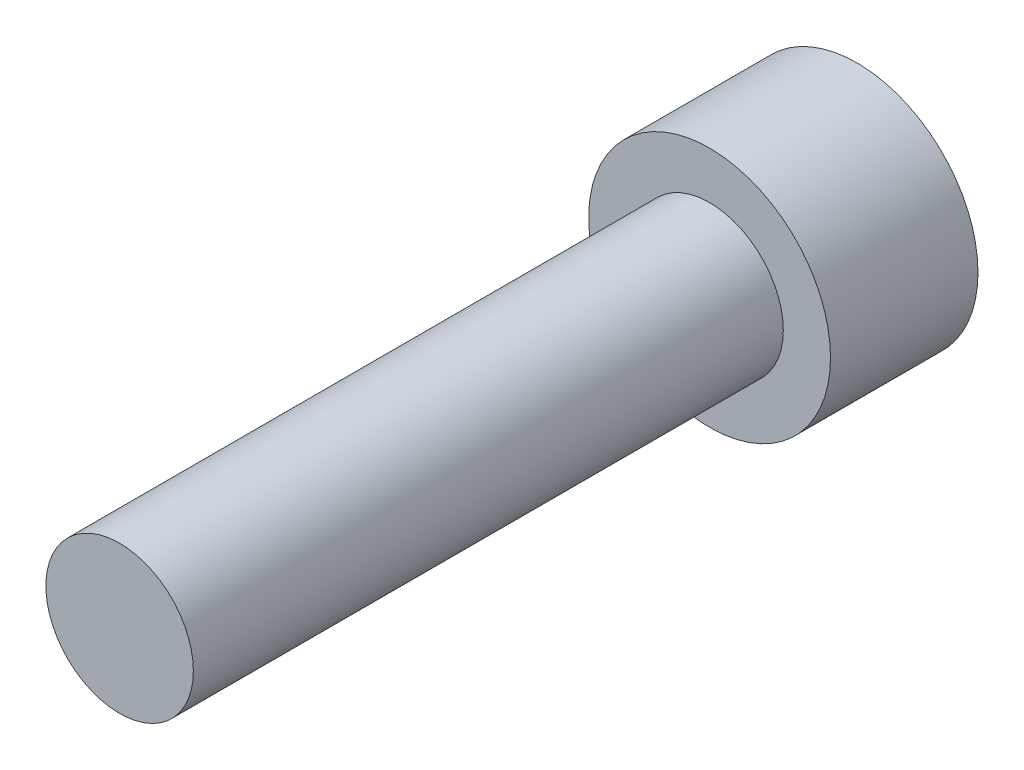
SolidWorks part; units mm, degrees
ref_plane "Front Plane" through (0, 0, 0) normal (0, 0, 1) x (1, 0, 0)
ref_plane "Top Plane" through (0, 0, 0) normal (0, 1, 0) x (1, 0, 0)
ref_plane "Right Plane" through (0, 0, 0) normal (1, 0, 0) x (0, 0, -1)
sketch "Sketch6" plane through (0, 0, 0) normal (1, 0, 0) x (0, 0, -1)
  line L0 (-12.7, 0) -> (22.525, 0) construction
  line L1 (2.8638, 0) -> (-2.8638, 0) construction
  line L2 (-12.7, 0) -> (-12.7, -1.5875)
  line L3 (-12.7, -1.5875) -> (0, -1.5875)
  line L4 (0, 2.8638) -> (0, -2.8638) construction
  line L5 (0, -1.5875) -> (0, -2.6035)
  line L6 (0, -2.6035) -> (3.175, -2.6035)
  line L7 (3.175, -2.6035) -> (3.175, 0)
  line L8 (3.175, 0) -> (-12.7, 0)
  dimension "L" = 12.7
  dimension "H" = 3.175
  dimension "A" = 5.207
  dimension "D" = 3.175
revolve "Revolve1" add sketch "Sketch6" angle 360 about L0
sketch "Sketch7" plane through (0, 0, -3.175) normal (0, 0, -1) x (-1, 0, 0)
  line L2 (-1.1811, 0.6819) -> (-1.1811, -0.6819)
  line L4 (-1.1811, -0.6819) -> (0, -1.3638)
  line L5 (0, -1.3638) -> (1.1811, -0.6819)
  line L6 (1.1811, -0.6819) -> (1.1811, 0.6819)
  line L7 (1.1811, 0.6819) -> (0, 1.3638)
  line L8 (0, 1.3638) -> (-1.1811, 0.6819)
  circle A0 centre (0, 0) radius 1.1811 construction
  dimension "J" = 2.3622
extrude "HEX" cut sketch "Sketch7" against normal blind 1.778
